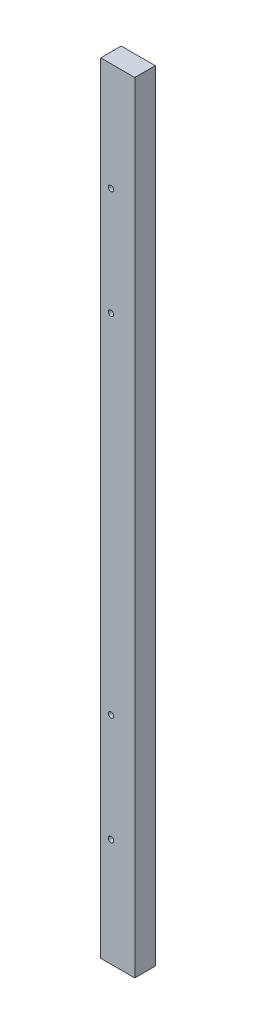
SolidWorks part; units mm, degrees
ref_plane "Front Plane" through (0, 0, 0) normal (0, 0, 1) x (1, 0, 0)
ref_plane "Top Plane" through (0, 0, 0) normal (0, 1, 0) x (1, 0, 0)
ref_plane "Right Plane" through (0, 0, 0) normal (1, 0, 0) x (0, 0, -1)
sketch "Sketch1" plane through (0, 0, 0) normal (0, 0, 1) x (1, 0, 0)
  line L1 (0, 0) -> (63, 0)
  line L2 (0, 0) -> (0, 1444)
  line L3 (0, 1444) -> (63, 1444)
  line L4 (63, 0) -> (63, 1444)
  dimension "D1" = 1444
  dimension "D2" = 63
extrude "Boss-Extrude1" add sketch "Sketch1" along normal blind 38
sketch "Sketch2" plane through (0, 0, 0) normal (-1, 0, 0) x (0, 0, 1)
  line L0 (19, 1444) -> (19, 0) construction
  line L1 (38, 1444) -> (0, 1444) construction
  line L2 (38, 0) -> (0, 0) construction
  line L3 (19, 1244) -> (19, 1044) construction
  line L4 (38, 722) -> (0, 722) construction
  line L5 (38, 1444) -> (38, 0) construction
  line L6 (0, 1444) -> (0, 0) construction
  circle A1 centre (19, 1244) radius 5
  circle A2 centre (19, 1044) radius 5
  circle A3 centre (19, 200) radius 5
  circle A4 centre (19, 400) radius 5
sketch "Sketch3" plane through (0, 0, 38) normal (0, 0, 1) x (1, 0, 0)
  line L0 (19, 1444) -> (19, 0) construction
  line L2 (0, 0) -> (63, 0) construction
  line L3 (19, 200) -> (19, 400) construction
  line L4 (0, 722) -> (63, 722) construction
  line L5 (63, 0) -> (63, 1444) construction
  line L6 (0, 1444) -> (0, 0) construction
  line L7 (63, 1444) -> (0, 1444) construction
  circle A0 centre (19, 200) radius 5
  circle A1 centre (19, 400) radius 5
  circle A2 centre (19, 1044) radius 5
  circle A3 centre (19, 1244) radius 5
extrude "Cut-Extrude1" cut sketch "Sketch3" against normal up to next
equation "\"Hole Diameter\"= 10"
equation "\"D1@Sketch2\"=\"Hole Diameter\""
equation "\"D1@Sketch3\"=\"Hole Diameter\""
